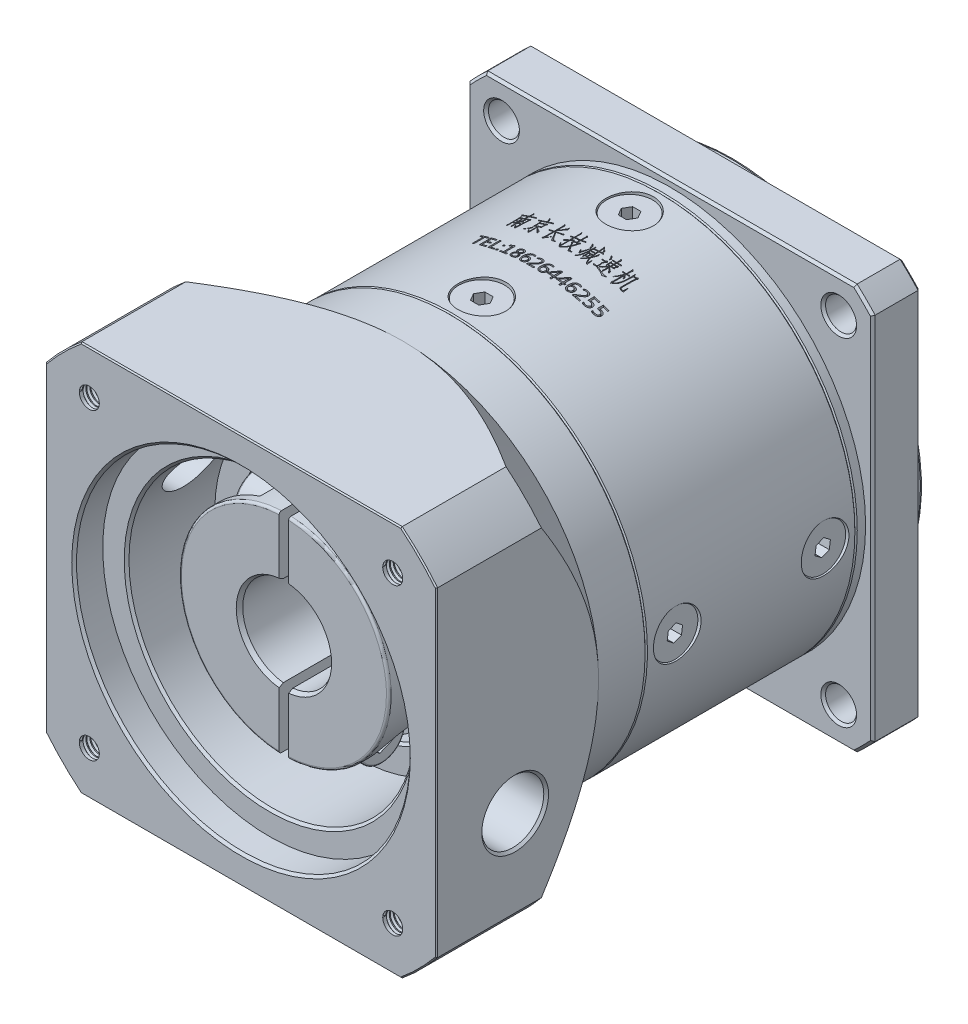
SolidWorks part; units mm, degrees
ref_plane "前视基准面" through (0, 0, 0) normal (0, 0, 1) x (1, 0, 0)
ref_plane "上视基准面" through (0, 0, 0) normal (0, 1, 0) x (1, 0, 0)
ref_plane "右视基准面" through (0, 0, 0) normal (1, 0, 0) x (0, 0, -1)
imported_body "19-70-90-M5-1-solid1"
imported_body "19-70-90-M5-1-solid2"
imported_body "19-70-90-M5-1-solid3"
imported_body "19-70-90-M5-1-solid4"
imported_body "ZF80-K15-L1-6-solid1"
imported_body "ZF80-K15-L1-6-solid2"
imported_body "ZF80-K15-L1-6-solid3"
imported_body "ZF80-K15-L1-6-solid4"
imported_body "ZF80-K15-L1-6-solid5"
imported_body "ZF80-K15-L1-6-solid6"
imported_body "ZF80-K15-L1-6-solid7"
imported_body "ZF80-K15-L1-6-solid8"
imported_body "ZF80-K15-L1-6-solid9"
sketch "草图1" plane through (0, 0, -41.9881) normal (0, 0, -1) x (-1, 0, 0)
  circle A0 centre (84.0682, 35.876) radius 10.9993
  dimension "D1" = 21.9986
extrude "凸台-拉伸1" add sketch "草图1" along normal blind 5
